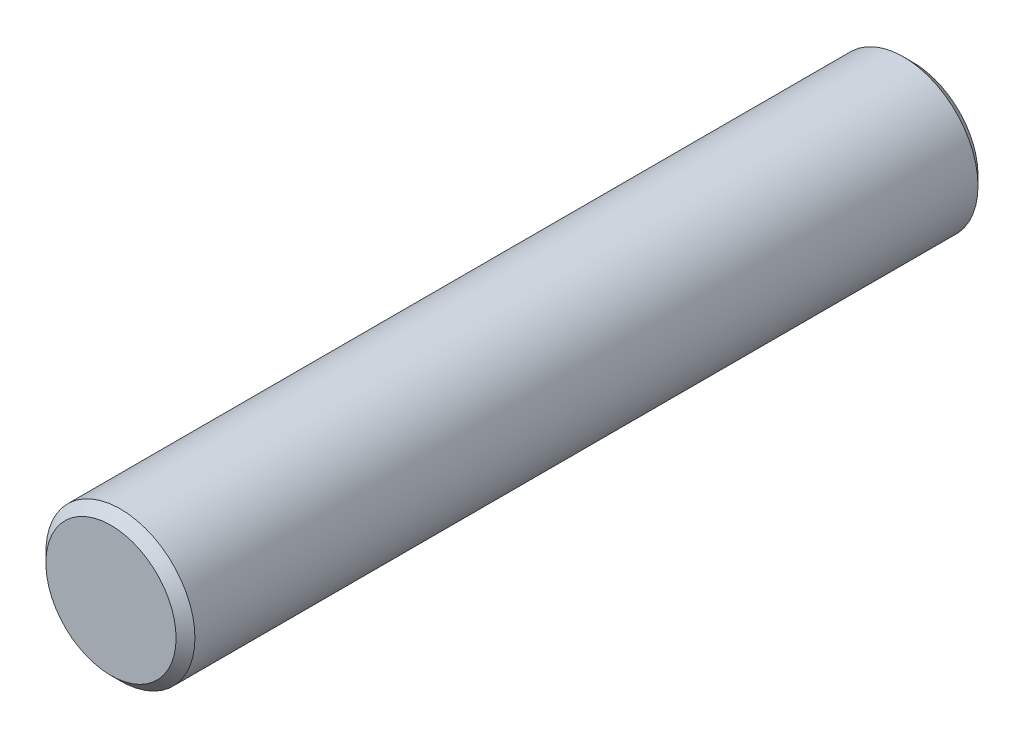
SolidWorks part; units mm, degrees
ref_plane "Plane1" through (0, 0, 0) normal (0, 0, 1) x (1, 0, 0)
ref_plane "Plane2" through (0, 0, 0) normal (0, 1, 0) x (1, 0, 0)
ref_plane "Plane3" through (0, 0, 0) normal (1, 0, 0) x (0, 0, -1)
sketch "Sketch1" plane through (0, 0, 0) normal (0, 0, 1) x (1, 0, 0)
  circle A0 centre (0, 0) radius 0.79
  dimension "D1" = 1.58
extrude "drive shaft pin shape" add sketch "Sketch1" along normal blind 8.5
chamfer "drive shaft pin chamfer" distance 0.1 angle 45
